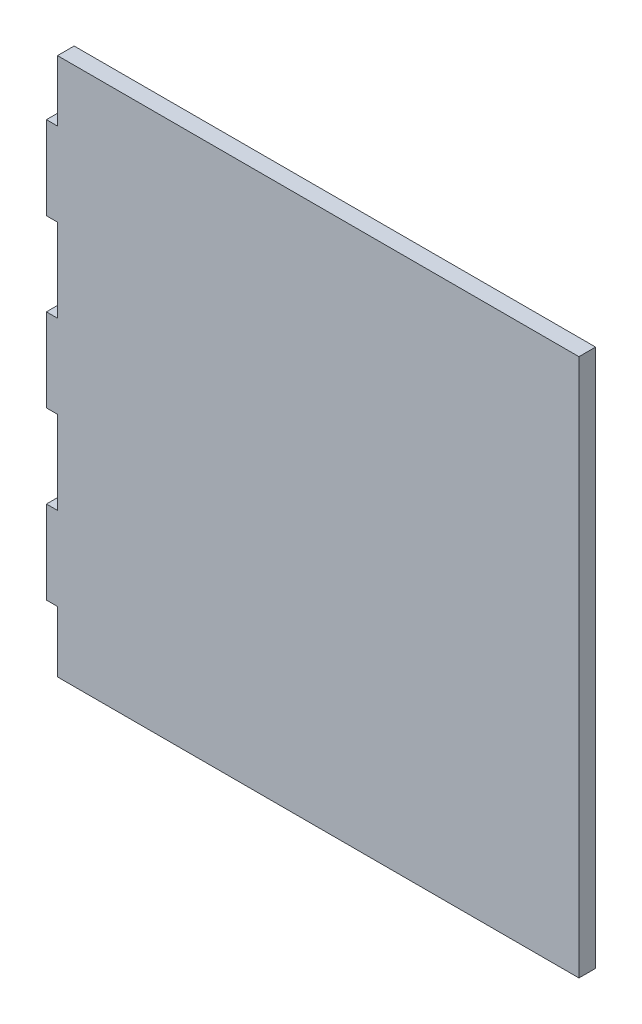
SolidWorks part; units mm, degrees
ref_plane "Front Plane" through (0, 0, 0) normal (0, 0, 1) x (1, 0, 0)
ref_plane "Top Plane" through (0, 0, 0) normal (0, 1, 0) x (1, 0, 0)
ref_plane "Right Plane" through (0, 0, 0) normal (1, 0, 0) x (0, 0, -1)
sketch "Sketch1" plane through (0, 0, 0) normal (0, 0, 1) x (1, 0, 0)
  line L0 (0, 0) -> (-4.5134, 0) construction
  line L1 (0, 0) -> (188, 0)
  line L2 (0, 0) -> (0, -194)
  line L3 (0, -194) -> (188, -194)
  line L4 (188, 0) -> (188, -194)
  line L5 (0, -22) -> (-4, -22)
  line L6 (0, -22) -> (0, -52)
  line L7 (0, -52) -> (-4, -52)
  line L8 (-4, -22) -> (-4, -52)
  line L9 (0, -82) -> (-4, -82)
  line L10 (0, -82) -> (0, -112)
  line L11 (0, -112) -> (-4, -112)
  line L12 (-4, -82) -> (-4, -112)
  line L13 (0, -142) -> (-4, -142)
  line L14 (0, -142) -> (0, -172)
  line L15 (0, -172) -> (-4, -172)
  line L16 (-4, -142) -> (-4, -172)
  line L17 (-2, 0) -> (-2, -22) construction
  line L18 (0, -194) -> (-11.7742, -194) construction
  line L19 (-2, -172) -> (-2, -194) construction
  point P17 (-2, -82)
extrude "Boss-Extrude1" add sketch "Sketch1" along normal blind 6 contours L4 L1 L2 L3 | L5 L8 L7 L2 | L13 L16 L15 L2 | L12 L11 L10 L9
equation "\"sheetThickness\"=0.63mm"
equation "\"flange\"= 11mm"
equation "\"baffleCutWidth\"= 28.58mm"
equation "\"baffleCutLength\"= 146.22mm"
equation "\"metalLength\" = 156.28mm"
equation "\"metalWidth\" = 35.5mm"
equation "\"pitch\" = 42mm"
equation "\"cabDepth\" = 130mm "
equation "\"overallDepth\" = \"cabDepth\" + 58mm   "
equation "\"D1@Sketch1\"=\"overallDepth\""
equation "\"D2@Sketch1\"=180+14"
